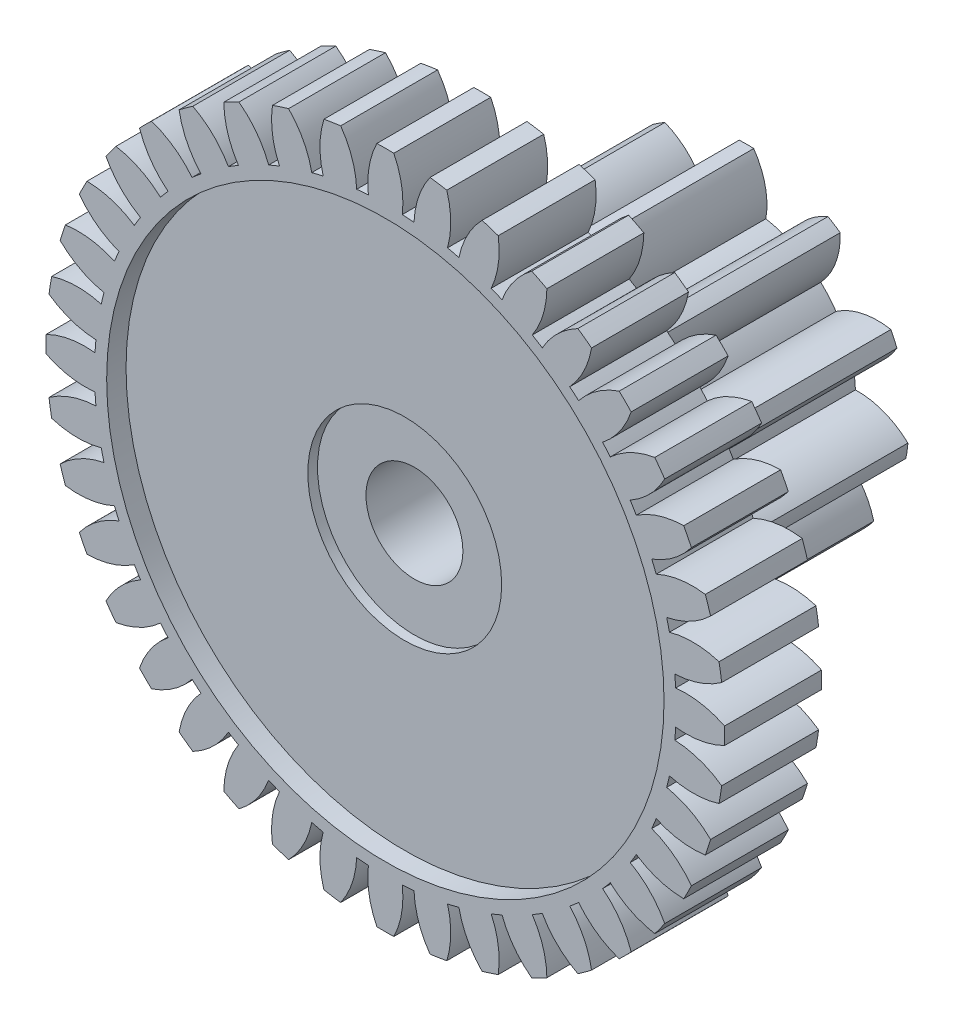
SolidWorks part; units mm, degrees
ref_plane "Front Plane" through (0, 0, 0) normal (0, 0, 1) x (1, 0, 0)
ref_plane "Top Plane" through (0, 0, 0) normal (0, 1, 0) x (1, 0, 0)
ref_plane "Right Plane" through (0, 0, 0) normal (1, 0, 0) x (0, 0, -1)
sketch "Sketch1" plane through (0, 0, 0) normal (0, 0, 1) x (1, 0, 0)
  circle A0 centre (0, 0) radius 6
  dimension "D1" = 12
extrude "Extrude1" add sketch "Sketch1" along normal mid plane 2
sketch "Sketch2" plane through (0, 0, 0) normal (0, 0, 1) x (1, 0, 0)
  line L0 (-7, 0) -> (-6, 0) construction
  arc A2 (-5.9898, 0.35) -> (-5.9898, -0.35) centre (0, 0) ccw
  arc A3 (-6.9978, -0.175) -> (-5.9898, -0.35) centre (-6.1986, 1.4378) ccw
  arc A4 (-6.9978, 0.175) -> (-6.9978, -0.175) centre (0, 0) ccw
  arc A5 (-5.9898, 0.35) -> (-6.9978, 0.175) centre (-6.1986, -1.4378) ccw
  circle A12 centre (0, 0) radius 6 construction
  point P7 (0, 0)
  dimension "D1" = 1
  dimension "D3" = 1.8
  dimension "D4" = 0.35
  dimension "D5" = 0.7
extrude "Extrude2" add sketch "Sketch2" against normal mid plane 2
pattern_circular "CirPattern1" count 40 over 360 about axis through (0, 0, 0) along (0, 0, 1) of "Extrude2"
sketch "Sketch3" plane through (0, 0, -1) normal (0, 0, -1) x (-1, 0, 0)
  circle A0 centre (0, 0) radius 2
  circle A1 centre (0, 0) radius 5.75
  dimension "D1" = 4
  dimension "D2" = 11.5
extrude "Cut-Extrude1" cut sketch "Sketch3" against normal blind 0.4
mirror "Mirror1" about plane through (0, 0, 0) normal (0, 0, 1) of "Cut-Extrude1"
sketch "Sketch4" plane through (0, 0, -0.6) normal (0, 0, -1) x (-1, 0, 0)
  line L0 (0, 2.6) -> (0, 0) construction
  circle A0 centre (0, 0) radius 2.25
  dimension "D1" = 4.5
extrude "Extrude3" add sketch "Sketch4" along normal blind 5.85
sketch "Sketch6" plane through (0, 0, -6.45) normal (0, 0, -1) x (-1, 0, 0)
  line L0 (0, 0) -> (0, 3.3487) construction
  arc A0 (0.15, 3.3444) -> (-0.15, 3.3444) centre (0, 0.7487) ccw
  arc A1 (-0.15, 3.3444) -> (-0.4, 2.2142) centre (1.0922, 2.4768) ccw
  arc A2 (0.4, 2.2142) -> (0.15, 3.3444) centre (-1.0922, 2.4768) ccw
  circle A3 centre (0, 0) radius 2.25 construction
  circle A4 centre (0, 0) radius 2.25 construction
  arc A5 (0.4, 2.2142) -> (-0.4, 2.2142) centre (0, 0) ccw
  point P1 (0, 2.25)
  point P12 (0, 0)
  dimension "D1" = 1.5151
  dimension "D2" = 0.8
  dimension "D5" = 2.6
  dimension "D3" = 0.2999
  dimension "D4" = 1.1302
extrude "Extrude4" add sketch "Sketch6" against normal up to surface (5.85 mm away)
pattern_circular "CirPattern2" count 11 over 360 about axis through (0, 0, 0) along (0, 0, 1) of "Extrude3", "Extrude4"
sketch "Sketch5" plane through (0, 0, -6.45) normal (0, 0, -1) x (-1, 0, 0)
  circle A0 centre (0, 0) radius 1
  dimension "D1" = 2
extrude "Cut-Extrude2" cut sketch "Sketch5" against normal up to surface (7.45 mm away)
sketch "Sketch7" plane through (0, 0, 1) normal (0, 0, 1) x (1, 0, 0)
  circle A1 centre (0, 0) radius 2
  circle A2 centre (0, 0) radius 2
  dimension "D1" = 0
extrude "Cut-Extrude3" cut sketch "Sketch7" against normal blind 0.6
